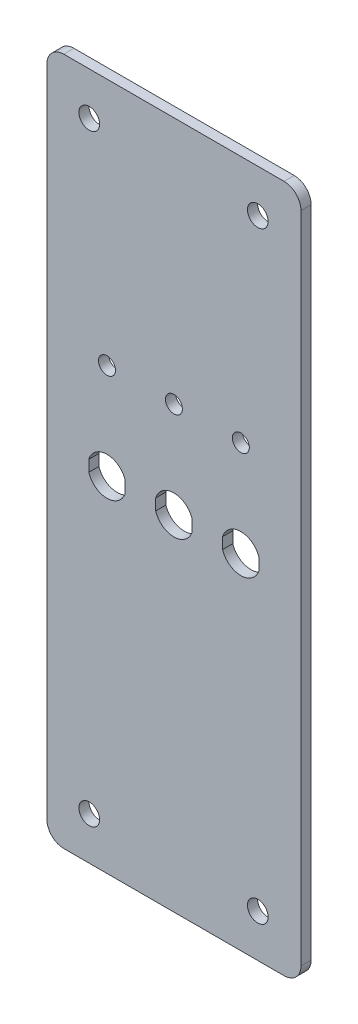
SolidWorks part; units mm, degrees
ref_plane "Front" through (0, 0, 0) normal (0, 0, 1) x (1, 0, 0)
ref_plane "Top" through (0, 0, 0) normal (0, 1, 0) x (1, 0, 0)
ref_plane "Right" through (0, 0, 0) normal (1, 0, 0) x (0, 0, -1)
sketch "Sketch1" plane through (0, 0, 0) normal (0, 0, 1) x (1, 0, 0)
  line L1 (-38.1, -103.1494) -> (38.1, -103.1494)
  line L2 (-38.1, -103.1494) -> (-38.1, 103.1494)
  line L3 (-38.1, 103.1494) -> (38.1, 103.1494)
  line L4 (38.1, -103.1494) -> (38.1, 103.1494)
  line L5 (-38.1, -103.1494) -> (38.1, 103.1494) construction
  line L6 (-38.1, 103.1494) -> (38.1, -103.1494) construction
  point P0 (0, 0)
  dimension "D1" = 76.2
  dimension "D2" = 206.2988
extrude "Boss-Extrude1" add sketch "Sketch1" along normal blind 3.048
sketch "Sketch3" plane through (0, 0, 3.048) normal (0, 0, 1) x (1, 0, 0)
  line L2 (-38.1, -103.1494) -> (38.1, -103.1494) construction
  line L3 (38.1, -103.1494) -> (38.1, 103.1494) construction
  line L5 (38.5116, 110.3644) -> (37.9285, 110.3644)
  line L6 (38.5116, 110.3644) -> (38.5116, 113.2211)
  line L7 (38.5116, 113.2211) -> (37.9285, 113.2211)
  line L8 (37.9285, 110.3644) -> (37.9285, 113.2211)
  line L9 (-38.1, 103.1494) -> (-38.1, -103.1494) construction
  circle A0 centre (-25.4, 90.3097) radius 3.0988
  circle A1 centre (25.146, 90.3097) radius 3.0988
  circle A2 centre (25.146, -90.3097) radius 3.0988
  circle A3 centre (-25.4, -90.3097) radius 3.0988
  dimension "D1" = 6.1976
  dimension "D2" = 6.1976
  dimension "D3" = 6.1976
  dimension "D4" = 6.1976
  dimension "D5" = 180.6194
  dimension "D6" = 180.6194
  dimension "D7" = 12.8397
  dimension "D8" = 12.8397
  dimension "D9" = 9.8552
  dimension "D11" = 12.7
  dimension "D12" = 12.7
  dimension "D10" = 9.8552
extrude "Cut-Extrude1" cut sketch "Sketch3" against normal through all
sketch "Sketch4" plane through (0, 0, 3.048) normal (0, 0, 1) x (1, 0, 0)
  line L0 (-5.461, 1.6848) -> (-5.461, -1.6848)
  line L1 (5.461, -1.6848) -> (5.461, 1.6848)
  line L2 (-10.033, 4.0361) -> (-10.033, -7.6082) construction
  line L3 (10.033, 4.7848) -> (10.033, -7.6082) construction
  line L4 (25.527, 1.6848) -> (25.527, -1.6848)
  line L5 (14.605, -1.6848) -> (14.605, 1.6848)
  line L6 (-14.605, 1.6848) -> (-14.605, -1.6848)
  line L7 (-25.527, -1.6848) -> (-25.527, 1.6848)
  arc A0 (5.461, 1.6848) -> (-5.461, 1.6848) centre (0, 0) ccw
  arc A1 (-5.461, -1.6848) -> (5.461, -1.6848) centre (0, 0) ccw
  arc A2 (25.527, -1.6848) -> (14.605, -1.6848) centre (20.066, 0) cw
  arc A3 (14.605, 1.6848) -> (25.527, 1.6848) centre (20.066, 0) cw
  arc A4 (-14.605, -1.6848) -> (-25.527, -1.6848) centre (-20.066, 0) cw
  arc A5 (-25.527, 1.6848) -> (-14.605, 1.6848) centre (-20.066, 0) cw
  dimension "D1" = 11.43
  dimension "D2" = 10.922
  dimension "D3" = 5.461
  dimension "D4" = 4.572
  dimension "D5" = 4.572
  dimension "D6" = 20.066
extrude "Cut-Extrude2" cut sketch "Sketch4" against normal through all
fillet "Fillet1" radius 5.08 4 edges at (-38.1, -103.1494, 1.524) (38.1, -103.1494, 1.524) (38.1, 103.1494, 1.524) (-38.1, 103.1494, 1.524)
sketch "Sketch5" plane through (0, 0, 3.048) normal (0, 0, 1) x (1, 0, 0)
  line L0 (10.033, 4.7463) -> (10.033, 34.1049) construction
  line L2 (-10.033, 34.1049) -> (-10.033, -3.2688) construction
  circle A0 centre (0, 28.7782) radius 2.54
  arc A1 (5.461, 1.6848) -> (-5.461, 1.6848) centre (0, 0) ccw construction
  circle A2 centre (-20.066, 28.7782) radius 2.54
  circle A3 centre (20.066, 28.7782) radius 2.54
  dimension "D1" = 5.08
  dimension "D2" = 28.7782
  dimension "D4" = 10.033
extrude "Cut-Extrude3" cut sketch "Sketch5" against normal blind 3.0988
